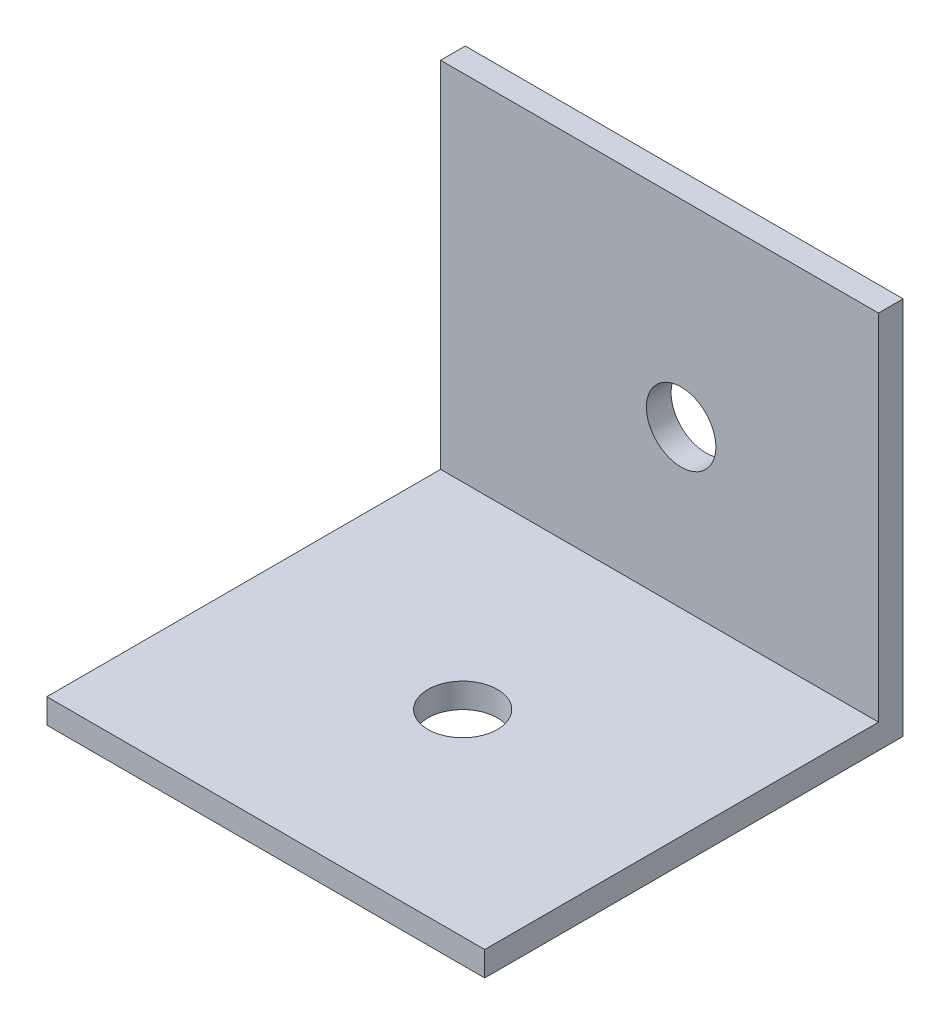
SolidWorks part; units mm, degrees
ref_plane "Front" through (0, 0, 0) normal (0, 0, 1) x (1, 0, 0)
ref_plane "Top" through (0, 0, 0) normal (0, 1, 0) x (1, 0, 0)
ref_plane "Right" through (0, 0, 0) normal (1, 0, 0) x (0, 0, -1)
sketch "Sketch1" plane through (0, 0, 0) normal (0, 0, 1) x (1, 0, 0)
  line L1 (-209.8261, 67.8385) -> (196.5739, 67.8385)
  line L2 (-209.8261, 67.8385) -> (-209.8261, 43.4545)
  line L3 (-209.8261, 43.4545) -> (196.5739, 43.4545)
  line L4 (196.5739, 67.8385) -> (196.5739, 43.4545)
  dimension "D1" = 406.4
  dimension "D2" = 24.384
extrude "Boss-Extrude1" add sketch "Sketch1" along normal blind 26.924
sketch "Sketch2" plane through (0, 67.8385, 0) normal (0, 1, 0) x (1, 0, 0)
  line L0 (-209.8261, -26.924) -> (-209.8261, 0) construction
  line L1 (-209.8261, -1.5875) -> (196.5739, -1.5875)
  line L2 (-209.8261, -1.5875) -> (-209.8261, -26.924)
  line L3 (-209.8261, -26.924) -> (196.5739, -26.924)
  line L4 (196.5739, -1.5875) -> (196.5739, -26.924)
  line L5 (196.5739, 0) -> (-209.8261, 0) construction
  dimension "D1" = 1.5875
extrude "Cut-Extrude1" cut sketch "Sketch2" against normal blind 12.7
sketch "Sketch3" plane through (0, 0, 26.924) normal (0, 0, 1) x (1, 0, 0)
  line L0 (196.5739, 43.4545) -> (196.5739, 55.1385) construction
  line L1 (-209.8261, 55.1385) -> (196.5739, 55.1385)
  line L2 (-209.8261, 55.1385) -> (-209.8261, 45.042)
  line L3 (-209.8261, 45.042) -> (196.5739, 45.042)
  line L4 (196.5739, 55.1385) -> (196.5739, 45.042)
  line L5 (-209.8261, 43.4545) -> (196.5739, 43.4545) construction
  dimension "D1" = 1.5875
extrude "Cut-Extrude3" cut sketch "Sketch3" against normal up to surface (25.3365 mm away)
sketch "Sketch5" plane through (0, 0, 0) normal (0, 0, -1) x (-1, 0, 0)
  line L0 (6.6261, 77.4225) -> (6.6261, -19.794) construction
  line L1 (-196.5739, 67.8385) -> (209.8261, 67.8385) construction
  line L2 (-196.5739, 43.4545) -> (-196.5739, 67.8385) construction
  circle A0 centre (-183.8739, 55.1385) radius 2.2339
  circle A1 centre (197.1261, 55.1385) radius 2.2339
  dimension "D3" = 4.4679
  dimension "D1" = 12.7
  dimension "D2" = 12.7
extrude "Cut-Extrude5" cut sketch "Sketch5" against normal blind 2.54
sketch "Sketch6" plane through (0, 43.4545, 0) normal (0, -1, 0) x (1, 0, 0)
  line L1 (-240.9036, 79.0454) -> (168.3993, 79.0454)
  line L2 (-240.9036, 79.0454) -> (-240.9036, -85.6356)
  line L3 (-240.9036, -85.6356) -> (168.3993, -85.6356)
  line L4 (168.3993, 79.0454) -> (168.3993, -85.6356)
  point P4 (168.3993, 79.0454)
extrude "Cut-Extrude6" cut sketch "Sketch6" against normal blind 65.024
sketch "Sketch7" plane through (0, 45.042, 0) normal (0, 1, 0) x (1, 0, 0)
  line L0 (168.3993, -1.5875) -> (168.3993, -26.924) construction
  line L1 (168.3993, -26.924) -> (196.5739, -26.924) construction
  circle A0 centre (182.4866, -14.2558) radius 2.2339
  point P4 (168.3993, -14.2558)
  point P7 (182.4866, -26.924)
  dimension "D1" = 4.4679
extrude "Cut-Extrude7" cut sketch "Sketch7" against normal blind 2.54
equation "\".5n\"=1"
